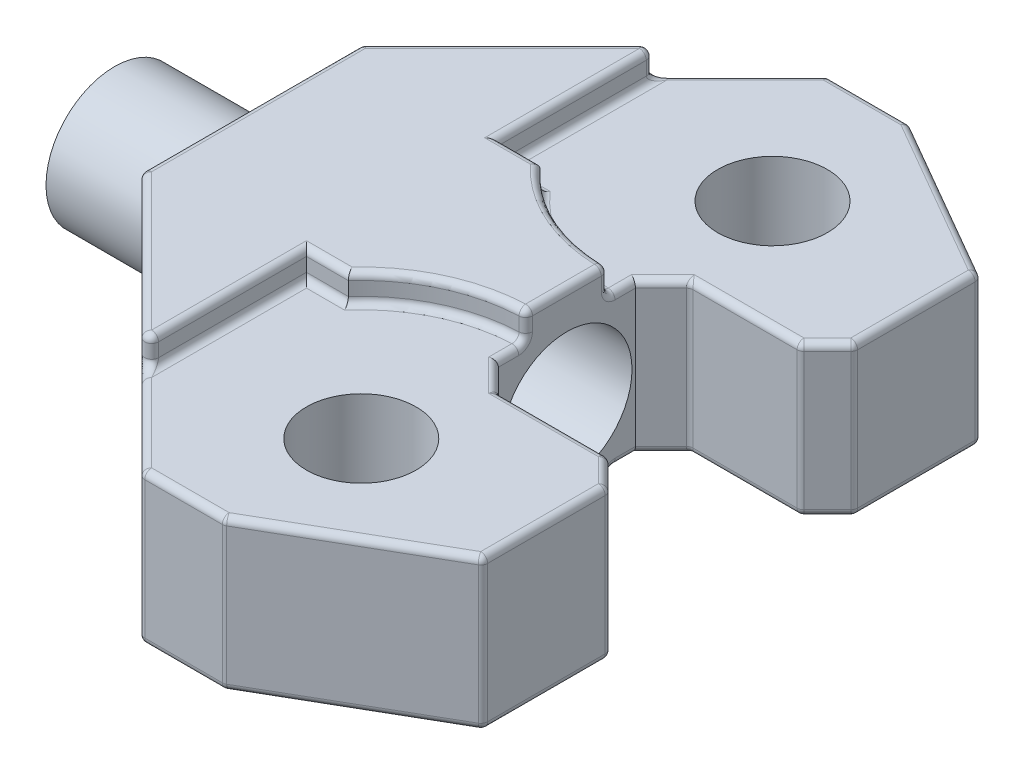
SolidWorks part; units mm, degrees
ref_plane "Plane1" through (0, 0, 0) normal (0, 0, 1) x (1, 0, 0)
ref_plane "Plane2" through (0, 0, 0) normal (0, 1, 0) x (1, 0, 0)
ref_plane "Plane3" through (0, 0, 0) normal (1, 0, 0) x (0, 0, -1)
sketch "Esquisse1" plane through (0, 0, 0) normal (0, 0, 1) x (1, 0, 0)
  line L0 (-5, 7.5) -> (-5, -7.5)
  line L1 (-5, 7.5) -> (6, 7.5)
  line L2 (6, 7.5) -> (6, 5.5)
  line L3 (6, 5.5) -> (30, 5.5)
  line L4 (-90, 0) -> (80, 0) construction
  line L5 (-5, -7.5) -> (6, -7.5)
  line L6 (6, -7.5) -> (6, -5.5)
  line L7 (6, -5.5) -> (30, -5.5)
  line L8 (30, 5.5) -> (30, -5.5)
  dimension "D1" = 35
  dimension "D2" = 11
  dimension "D3" = 15
  dimension "D4" = 11
extrude "Base-Extrusion" add sketch "Esquisse1" along normal blind 50
chamfer "Chanfrein1" distance 12 angle 30 1 edges at (30, 0, 50)
chamfer "Chanfrein3" distance 17 angle 45 10 edges at (6, -6.5, 50) (0.5, -7.5, 50) (-5, 0, 50) (0.5, 7.5, 50) (-5, 0, 0) (6, 6.5, 50) (0.5, -7.5, 0) (6, -6.5, 0) (6, 6.5, 0) (0.5, 7.5, 0)
sketch "Esquisse2" plane through (0, 5.5, 0) normal (0, 1, 0) x (-1, 0, 0)
  line L0 (-30, 43.0718) -> (-30, 0) construction
  line L1 (-6, 25) -> (-47.0432, 25) construction
  line L2 (-6, 44) -> (-6, 6) construction
  circle A0 centre (-18, 10) radius 4
  circle A1 centre (-18, 40) radius 4
  dimension "D1" = 8
  dimension "D2" = 12
extrude "Enlèv. mat.-Extru.1" cut sketch "Esquisse2" against normal through all
chamfer "Chanfrein4" distance 12 angle 30 1 edges at (30, 0, 0)
sketch "Esquisse3" plane through (-5, 0, 0) normal (-1, 0, 0) x (0, 0, 1)
  line L0 (33, -7.5) -> (17, -7.5) construction
  line L1 (17, 7.5) -> (17, -7.5) construction
  circle A0 centre (25, 0) radius 5
  dimension "D1" = 10
  dimension "D3" = 8
  dimension "D2" = 7.5
extrude "Extrusion1" add sketch "Esquisse3" along normal blind 10
sketch "Esquisse4" plane through (-15, 0, 0) normal (-1, 0, 0) x (0, 0, 1)
  circle A0 centre (25, 0) radius 2.75
  dimension "D1" = 5.5
extrude "Enlèv. mat.-Extru.2" cut sketch "Esquisse4" against normal blind 47
sketch "Esquisse5" plane through (30, 0, 0) normal (1, 0, 0) x (0, 0, -1)
  circle A0 centre (-25, 0) radius 4.75
  dimension "D1" = 9.5
extrude "Enlèv. mat.-Extru.3" cut sketch "Esquisse5" against normal blind 26
sketch "Esquisse6" plane through (6, 0, 0) normal (1, 0, 0) x (0, 0, -1)
  line L0 (-44, -7.5) -> (-6, -7.5) construction
  line L1 (-32, -7.5) -> (-18, -7.5)
  line L2 (-32, -7.5) -> (-32, -5.5)
  line L3 (-32, -5.5) -> (-18, -5.5)
  line L4 (-18, -7.5) -> (-18, -5.5)
  line L5 (-44, -5.5) -> (-6, -5.5) construction
  circle A0 centre (-25, 0) radius 2.75 construction
  circle A1 centre (-25, 0) radius 4.75 construction
  dimension "D1" = 7
  dimension "D2" = 7
extrude "Extrusion2" add sketch "Esquisse6" along normal blind 24
mirror "Symétrie1" about plane through (0, 0, 0) normal (0, 1, 0) of "Extrusion2"
sketch "Esquisse7" plane through (0, 5.5, 0) normal (0, 1, 0) x (-1, 0, 0)
  circle A0 centre (-18, 10) radius 12
  circle A1 centre (-18, 40) radius 12
  dimension "D1" = 24
extrude "Enlèv. mat.-Extru.4" cut sketch "Esquisse7" along normal blind 10
sketch "Esquisse8" plane through (0, -5.5, 0) normal (0, -1, 0) x (1, 0, 0)
  circle A0 centre (18, 10) radius 12
  circle A1 centre (18, 40) radius 12
  dimension "D1" = 24
  dimension "D2" = 24
extrude "Enlèv. mat.-Extru.5" cut sketch "Esquisse8" along normal blind 13
sketch "Esquisse9" plane through (0, 7.5, 0) normal (0, 1, 0) x (-1, 0, 0)
  line L0 (-9.0557, 32) -> (-6, 32) construction
  line L1 (-30, 18) -> (-18, 18)
  line L2 (-30, 18) -> (-30, 32)
  line L3 (-30, 32) -> (-18, 32)
  line L4 (-18, 18) -> (-18, 32)
  line L5 (-30, 43.0718) -> (-30, 32) construction
  dimension "D1" = 12
extrude "Enlèv. mat.-Extru.6" cut sketch "Esquisse9" against normal blind 19
chamfer "Chanfrein5" distance 2 angle 45 4 edges at (30, 0, 18) (30, 0, 32) (18, 0, 18) (18, 0, 32)
fillet "Congé1" radius 0.5 20 edges at (7.5279, -7.5, 18) (6, -7.5, 12) (0.5, -7.5, 11.5) (-5, -7.5, 25) (0.5, -7.5, 38.5) (6, -7.5, 38) (7.5279, -7.5, 32) (13.101, -7.5, 29.0455) (18, -7.5, 25) (13.101, -7.5, 20.9545) (13.101, 7.5, 29.0455) (7.5279, 7.5, 32) (6, 7.5, 38) (0.5, 7.5, 38.5) (-5, 7.5, 25) (0.5, 7.5, 11.5) (6, 7.5, 12) (7.5279, 7.5, 18) (13.101, 7.5, 20.9545) (18, 7.5, 25)
fillet "Congé2" radius 0.5 15 edges at (5.8536, -7.3536, 43.6464) (17.9354, -7.2459, 27.9355) (6, -6.25, 44) (18, -6.25, 28) (15, -5.5, 50) (9, -5.5, 47) (6, -5.5, 38) (7.5279, -5.5, 32) (13.101, -5.5, 29.0455) (18, -5.5, 29) (19, -5.5, 31) (24, -5.5, 32) (29, -5.5, 33) (30, -5.5, 38.5359) (24, -5.5, 46.5359)
fillet "Congé3" radius 0.5 45 edges at (5.8536, 7.3536, 43.6464) (17.9354, 7.2459, 27.9355) (5.8536, 7.3536, 6.3536) (17.9354, 7.2459, 22.0645) (17.9354, -7.2459, 22.0645) (5.8536, -7.3536, 6.3536) (6, 6.25, 44) (18, 6.25, 28) (6, 6.25, 6) (18, 6.25, 22) (18, -6.25, 22) (6, -6.25, 6) (6, 5.5, 38) (9, 5.5, 47) (15, 5.5, 50) (24, 5.5, 46.5359) (30, 5.5, 38.5359) (29, 5.5, 33) (24, 5.5, 32) (19, 5.5, 31) (18, 5.5, 29) (13.101, 5.5, 29.0455) (7.5279, 5.5, 32) (7.5279, 5.5, 18) (6, 5.5, 12) (9, 5.5, 3) (15, 5.5, 0) (24, 5.5, 3.4641) (30, 5.5, 11.4641) (29, 5.5, 17) (24, 5.5, 18) (19, 5.5, 19) (18, 5.5, 21) (13.101, 5.5, 20.9545) (18, -5.5, 21) (19, -5.5, 19) (24, -5.5, 18) (29, -5.5, 17) (30, -5.5, 11.4641) (24, -5.5, 3.4641) (15, -5.5, 0) (9, -5.5, 3) (6, -5.5, 12) (7.5279, -5.5, 18) (13.101, -5.5, 20.9545)
fillet "Congé4" radius 1.5 1 edges at (-5, 0, 20)
fillet "Congé5" radius 0.5 42 edges at (19.9393, 5.3536, 17.8536) (19.9393, -5.3536, 17.8536) (27.9393, -5.3536, 17.8536) (27.9393, 5.3536, 17.8536) (29.8536, 5.3536, 15.9393) (29.8536, -5.3536, 15.9393) (29.8536, -5.3536, 7.0128) (29.8536, 5.3536, 7.0128) (17.9608, 5.3536, 0.1464) (17.9608, -5.3536, 0.1464) (12.0607, -5.3536, 0.1464) (12.0607, 5.3536, 0.1464) (-4.8536, 7.3536, 17.0607) (-4.8536, -7.3536, 17.0607) (-4.8536, -7.3536, 32.9393) (-4.8536, 7.3536, 32.9393) (12.0607, 5.3536, 49.8536) (12.0607, -5.3536, 49.8536) (17.9608, -5.3536, 49.8536) (17.9608, 5.3536, 49.8536) (29.8536, 5.3536, 42.9872) (29.8536, -5.3536, 42.9872) (29.8536, -5.3536, 34.0607) (29.8536, 5.3536, 34.0607) (27.9393, 5.3536, 32.1464) (27.9393, -5.3536, 32.1464) (19.9393, -5.3536, 32.1464) (19.9393, 5.3536, 32.1464) (20, 0, 18) (28, 0, 18) (30, 0, 16) (30, 0, 6.9282) (18, 0, 0) (12, 0, 0) (-5, 0, 17) (-5, 0, 33) (12, 0, 50) (18, 0, 50) (30, 0, 43.0718) (30, 0, 34) (28, 0, 32) (20, 0, 32)
sketch "Esquisse10" plane through (-15, 0, 0) normal (-1, 0, 0) x (0, 0, 1)
  circle A0 centre (25, 0) radius 4
  dimension "D1" = 8
extrude "Enlèv. mat.-Extru.7" cut sketch "Esquisse10" against normal blind 2
chamfer "Chanfrein6" distance 0.5 angle 45 1 edges at (-15, 0, 29)
